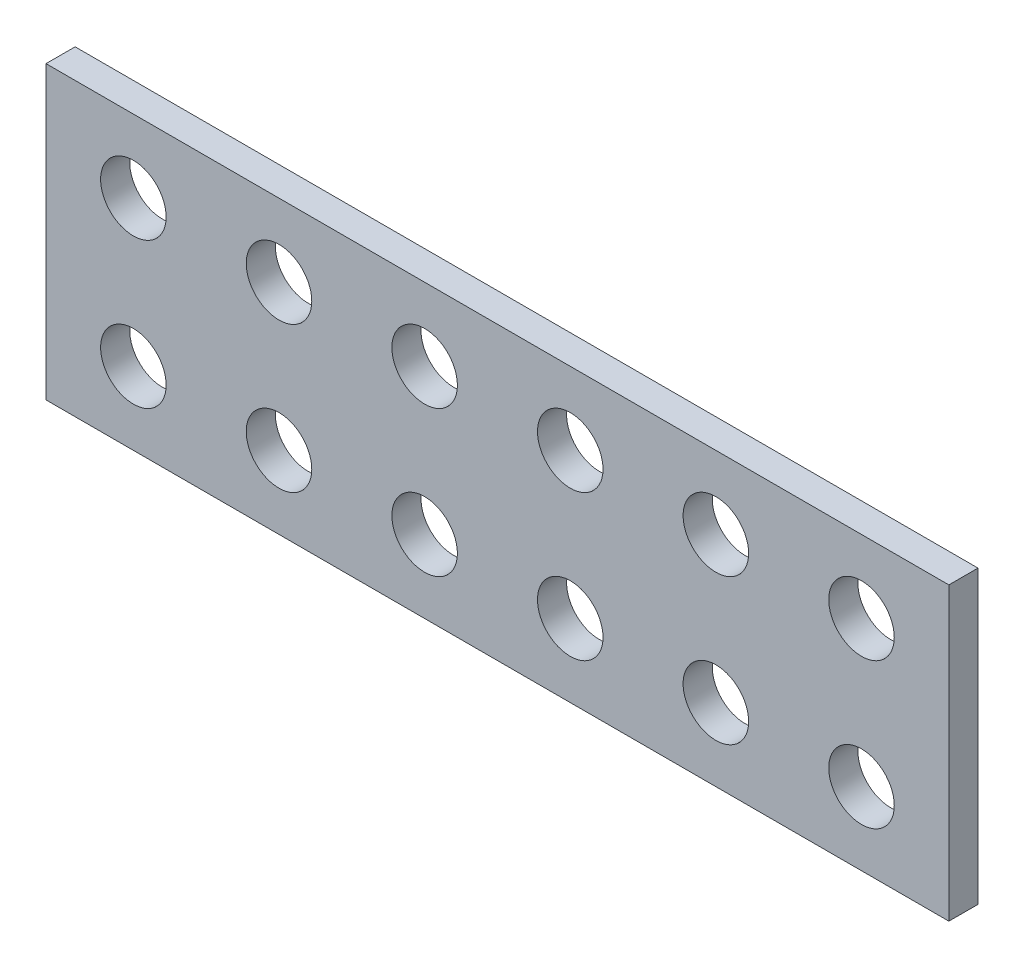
SolidWorks part; units mm, degrees
ref_plane "前视基准面" through (0, 0, 0) normal (0, 0, 1) x (1, 0, 0)
ref_plane "上视基准面" through (0, 0, 0) normal (0, 1, 0) x (1, 0, 0)
ref_plane "右视基准面" through (0, 0, 0) normal (1, 0, 0) x (0, 0, -1)
sketch "草图1" plane through (0, 0, 0) normal (0, 0, 1) x (1, 0, 0)
  line L1 (0, 0) -> (140, 0)
  line L2 (0, 0) -> (0, 60)
  line L3 (0, 60) -> (140, 60)
  line L4 (140, 0) -> (140, 60)
  dimension "D1" = 140
  dimension "D2" = 60
extrude "凸台-拉伸1" add sketch "草图1" along normal blind 4
sketch "草图2" plane through (0, 0, 4) normal (0, 0, 1) x (1, 0, 0)
  circle A12 centre (20, 40) radius 4.5
  circle A13 centre (40, 40) radius 4.5
  circle A14 centre (60, 40) radius 4.5
  circle A15 centre (80, 40) radius 4.5
  circle A16 centre (100, 40) radius 4.5
  circle A17 centre (120, 40) radius 4.5
  circle A18 centre (40, 20) radius 4.5
  circle A19 centre (60, 20) radius 4.5
  circle A20 centre (80, 20) radius 4.5
  circle A21 centre (100, 20) radius 4.5
  circle A22 centre (120, 20) radius 4.5
  circle A23 centre (20, 20) radius 4.5
  dimension "D4" = 9
  dimension "D5" = 6
  dimension "D6" = 2
extrude "切除-拉伸1" cut sketch "草图2" against normal through all
sketch "草图3" plane through (0, 0, 4) normal (0, 0, 1) x (1, 0, 0)
  line L0 (140, 60) -> (0, 60) construction
  line L1 (8, 10) -> (132, 10)
  line L2 (8, 10) -> (8, 50)
  line L3 (8, 50) -> (132, 50)
  line L4 (132, 10) -> (132, 50)
  line L5 (0, 0) -> (140, 0) construction
  line L6 (0, 60) -> (0, 0) construction
  line L7 (140, 0) -> (140, 60) construction
  point P10 (0, 30)
  dimension "D1" = 10
  dimension "D2" = 10
  dimension "D3" = 8
  dimension "D4" = 8
extrude "切除-拉伸2" cut sketch "草图3" against normal through all flip side to cut
